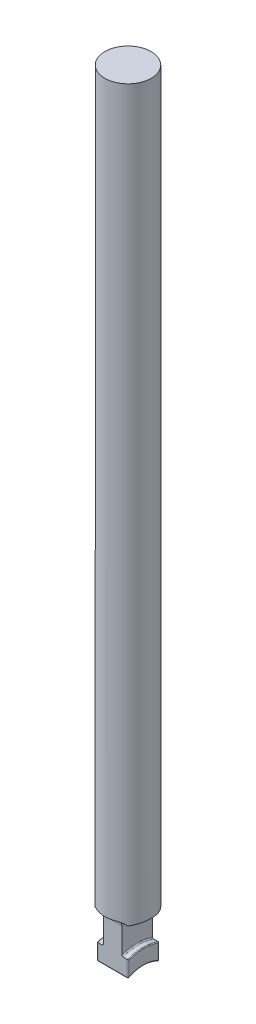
SolidWorks part; units mm, degrees
ref_plane "Front Plane" through (0, 0, 0) normal (0, 0, 1) x (1, 0, 0)
ref_plane "Top Plane" through (0, 0, 0) normal (0, 1, 0) x (1, 0, 0)
ref_plane "Right Plane" through (0, 0, 0) normal (1, 0, 0) x (0, 0, -1)
sketch "Sketch1" plane through (0, 0, 0) normal (1, 0, 0) x (0, 0, -1)
  line L0 (-7.5, 260) -> (-7.5, 0)
  line L1 (0, 249.2329) -> (0, 0) construction
  line L2 (7.5, 260) -> (7.5, 0)
  line L3 (-7.5, 260) -> (7.5, 260)
  line L6 (-7.5, 0) -> (7.5, 0)
  arc A0 (-10, 0) -> (10, 0) centre (0, 0) cw construction
  dimension "R" = 10
  dimension "L" = 250
  dimension "T" = 15
extrude "Boss-Extrude1" add sketch "Sketch1" along normal mid plane 15
sketch "Sketch8" plane through (0, 0, 0) normal (1, 0, 0) x (0, 0, -1)
  circle A0 centre (0, 0) radius 10
  arc A1 (10, 0) -> (-10, 0) centre (0, 0) ccw construction
extrude "Cut-Extrude4" cut sketch "Sketch8" against normal through all both and the other way through all
sketch "Sketch2" plane through (0, 0, 0) normal (0, 0, 1) x (1, 0, 0)
  line L0 (7.5, 15) -> (3, 15)
  line L1 (7.5, 260) -> (7.5, 6.6144) construction
  line L2 (3, 15) -> (3, 24.5)
  line L3 (3, 24.5) -> (7.5, 24.5)
  line L4 (7.5, 24.5) -> (7.5, 15)
  line L5 (0, 29.9173) -> (0, 0) construction
  line L6 (-7.5, 24.5) -> (-7.5, 15)
  line L7 (-3, 24.5) -> (-7.5, 24.5)
  line L8 (-3, 15) -> (-3, 24.5)
  line L9 (-7.5, 15) -> (-3, 15)
  line L10 (-8.8482, 0) -> (24.5305, 0) construction
  dimension "D1" = 6
  dimension "D2" = 24.5
  dimension "D3" = 15
revolve "Cut-Revolve1" cut sketch "Sketch2" angle 360 about L10
sketch "Sketch6" plane through (0, 0, 0) normal (1, 0, 0) x (0, 0, -1)
  line L0 (0, 19.903) -> (0, 0) construction
  line L1 (5, 0) -> (24.05, 0)
  line L2 (5, 0) -> (5, 22.6124)
  line L3 (7.3876, 25) -> (24.05, 25)
  line L4 (24.05, 0) -> (24.05, 25)
  line L9 (-5, 0) -> (-24.05, 0)
  line L10 (-24.05, 0) -> (-24.05, 25)
  line L11 (-7.3876, 25) -> (-24.05, 25)
  line L12 (-5, 0) -> (-5, 22.6124)
  arc A0 (5, 22.6124) -> (7.3876, 25) centre (7.3876, 22.6124) cw
  arc A1 (-5, 22.6124) -> (-7.3876, 25) centre (-7.3876, 22.6124) ccw
  dimension "D3" = 2.3876
  dimension "D1" = 25
  dimension "MT" = 10
  dimension "D2" = 19.05
extrude "Cut-Extrude2" cut sketch "Sketch6" against normal through all both and the other way through all
sketch "Sketch7" plane through (0, 0, 0) normal (0, 0, 1) x (1, 0, 0)
  line L6 (-7.5, 15) -> (-5, 15)
  line L8 (-7.5, 15) -> (-7.5, 0)
  line L9 (-7.5, 0) -> (-5, 0)
  line L10 (-5, 15) -> (-5, 0)
  line L11 (0, 16.5651) -> (0, 5.9342) construction
  line L12 (5, 15) -> (5, 0)
  line L13 (7.5, 0) -> (5, 0)
  line L14 (7.5, 15) -> (7.5, 0)
  line L15 (7.5, 15) -> (5, 15)
  dimension "MW" = 10
extrude "Cut-Extrude3" cut sketch "Sketch7" against normal through all both and the other way through all
fillet "Fillet1" radius 0.762 2 edges at (-3, 24.5, 0) (3, 24.5, 0)
fillet "Fillet2" radius 0.381 2 edges at (-3, 15, 0) (3, 15, 0)
fillet "Fillet3" radius 0.254 10 edges at (5, 11.4012, -5) (5, 11.4012, 5) (5, 15, 0) (-5, 11.4012, 5) (-5, 11.4012, -5) (-5, 15, 0) (5, 10, 0) (-5, 10, 0) (0, 8.6603, -5) (0, 8.6603, 5)
sketch "Sketch9" plane through (0, 260, 0) normal (0, 1, 0) x (1, 0, 0)
  circle A0 centre (0, 0) radius 7.5
  dimension "D1" = 15
extrude "Cut-Extrude5" cut sketch "Sketch9" against normal through all flip side to cut
